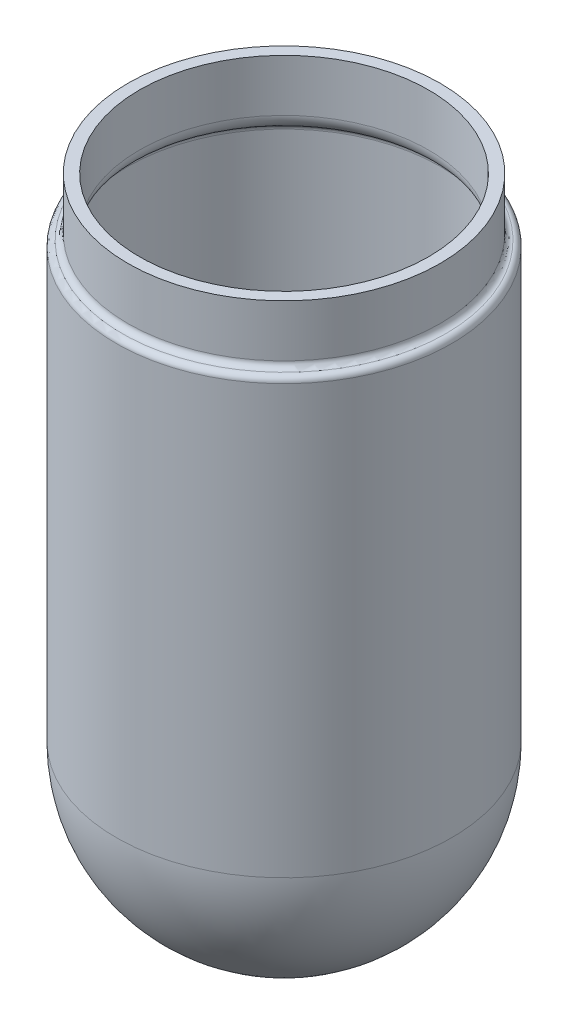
SolidWorks part; units mm, degrees
ref_plane "Front" through (0, 0, 0) normal (0, 0, 1) x (1, 0, 0)
ref_plane "Top" through (0, 0, 0) normal (0, 1, 0) x (1, 0, 0)
ref_plane "Right" through (0, 0, 0) normal (1, 0, 0) x (0, 0, -1)
sketch "Sketch1" plane through (0, 0, 0) normal (0, 0, 1) x (1, 0, 0)
  line L0 (0, 0) -> (0, -230.1875) construction
  line L1 (0, -49.2125) -> (-42.8625, -49.2125)
  line L2 (-42.8625, -49.2125) -> (-42.8625, -65.0875)
  line L3 (-42.8625, -65.0875) -> (-46.0375, -65.0875)
  line L4 (-46.0375, -65.0875) -> (-46.0375, -184.15)
  line L5 (0, -230.1875) -> (15.2413, -230.1875) construction
  line L6 (-46.0375, -65.0875) -> (46.0375, -65.0875) construction
  line L8 (-42.8625, -46.0375) -> (-42.8625, -61.9125) construction
  line L11 (0, -49.2125) -> (0, -230.1875)
  arc A0 (-46.0375, -184.15) -> (0, -230.1875) centre (0, -184.15) ccw
  dimension "D1" = 165.1
  dimension "D2" = 15.875
  dimension "D3" = 92.075
revolve "Revolve1" add sketch "Sketch1" angle 360 about L0
fillet "Fillet1" radius 1.5875 2 edges at (-46.0375, -65.0875, 0) (-42.8625, -65.0875, 0)
shell "Shell1" thickness 3.175
fillet "Fillet3" radius 1.5875 1 edges at (-42.8625, -67.9901, 0)
